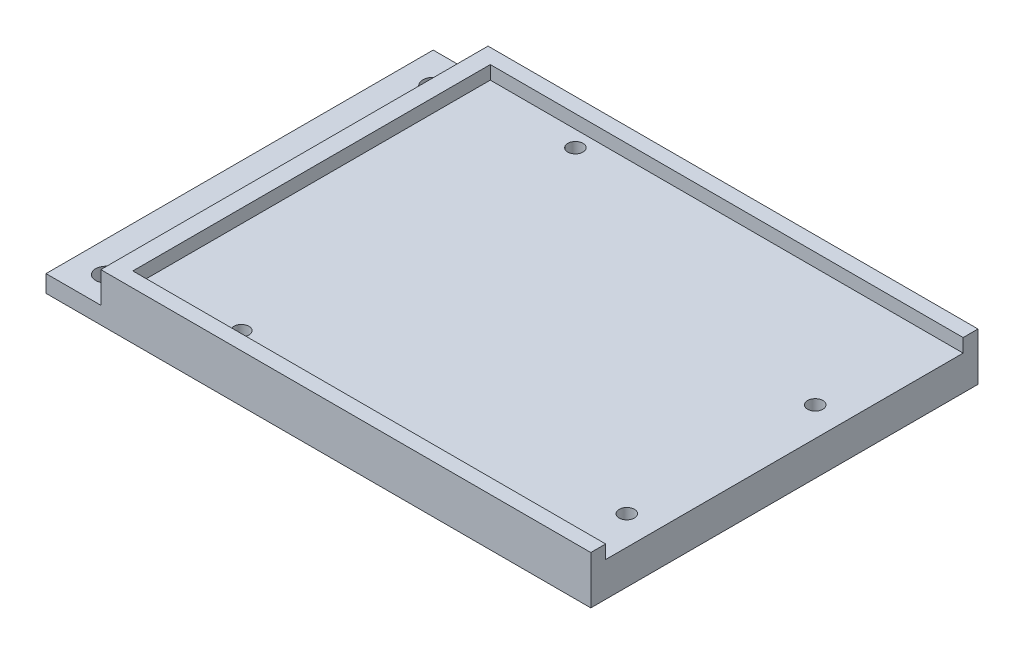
SolidWorks part; units mm, degrees
ref_plane "Front Plane" through (0, 0, 0) normal (0, 0, 1) x (1, 0, 0)
ref_plane "Top Plane" through (0, 0, 0) normal (0, 1, 0) x (1, 0, 0)
ref_plane "Right Plane" through (0, 0, 0) normal (1, 0, 0) x (0, 0, -1)
sketch "Sketch1" plane through (0, 0, 0) normal (0, 1, 0) x (1, 0, 0)
  line L1 (-40.386, 28.702) -> (40.386, 28.702)
  line L2 (-40.386, 28.702) -> (-40.386, -28.702)
  line L3 (-40.386, -28.702) -> (40.386, -28.702)
  line L4 (40.386, 28.702) -> (40.386, -28.702)
  line L5 (-40.386, 28.702) -> (40.386, -28.702) construction
  line L6 (-40.386, -28.702) -> (40.386, 28.702) construction
  point P0 (0, 0)
  dimension "D1" = 57.404
  dimension "D2" = 80.772
extrude "Boss-Extrude1" add sketch "Sketch1" along normal blind 7.112
sketch "Sketch2" plane through (0, 0, 28.702) normal (0, 0, 1) x (1, 0, 0)
  line L0 (-40.386, 2.54) -> (-32.258, 2.54)
  line L1 (-40.386, 7.112) -> (-40.386, 0) construction
  line L2 (-32.258, 2.54) -> (-32.258, 7.112)
  line L3 (-40.386, 7.112) -> (40.386, 7.112) construction
  line L4 (-32.258, 7.112) -> (-40.386, 7.112)
  line L5 (-40.386, 7.112) -> (-40.386, 2.54)
  line L6 (-40.386, 0) -> (40.386, 0) construction
  dimension "D1" = 8.128
  dimension "D2" = 2.54
extrude "Cut-Extrude1" cut sketch "Sketch2" against normal through all both and the other way through all
sketch "Sketch4" plane through (0, 7.112, 0) normal (0, 1, 0) x (1, 0, 0)
  line L0 (40.386, -28.702) -> (40.386, 28.702) construction
  line L1 (-32.258, -28.702) -> (40.386, -28.702) construction
  line L2 (40.386, 28.702) -> (-32.258, 28.702) construction
  circle A0 centre (-14.732, 24.13) radius 1.1303
  circle A1 centre (-16.002, -24.13) radius 1.1303
  circle A2 centre (36.068, 8.89) radius 1.1303
  circle A3 centre (36.068, -19.05) radius 1.1303
  dimension "D2" = 2.2606
  dimension "D3" = 27.94
  dimension "D4" = 5.08
  dimension "D5" = 52.07
  dimension "D6" = 4.318
  dimension "D7" = 4.572
  dimension "D8" = 50.8
  dimension "D1" = 15.24
  dimension "D9" = 4.572
extrude "Cut-Extrude3" cut sketch "Sketch4" against normal through all and the other way through all
sketch "Sketch3" plane through (0, 2.54, 0) normal (0, 1, 0) x (1, 0, 0)
  circle A0 centre (-35.814, -24.384) radius 1.524
  circle A1 centre (-35.814, 24.13) radius 1.524
  circle A2 centre (-14.732, 24.13) radius 1.1303 construction
  circle A3 centre (-16.002, -24.13) radius 1.1303 construction
  dimension "D1" = 3.048
  dimension "D2" = 21.082
  dimension "D3" = 48.514
  dimension "D4" = 0.254
extrude "Cut-Extrude2" cut sketch "Sketch3" against normal through all both and the other way through all
sketch "Sketch5" plane through (0, 7.112, 0) normal (0, 1, 0) x (1, 0, 0)
  line L1 (-29.718, 26.5) -> (40.386, 26.5)
  line L2 (-29.718, 26.5) -> (-29.718, -26.5)
  line L3 (-29.718, -26.5) -> (40.386, -26.5)
  line L4 (40.386, 26.5) -> (40.386, -26.5)
  line L5 (-32.258, 28.702) -> (-32.258, -28.702) construction
  line L6 (40.386, -28.702) -> (40.386, 28.702) construction
  point P4 (-29.718, 0)
  point P9 (-32.258, 0)
  dimension "D1" = 53
  dimension "D2" = 2.54
extrude "Cut-Extrude4" cut sketch "Sketch5" against normal blind 2
